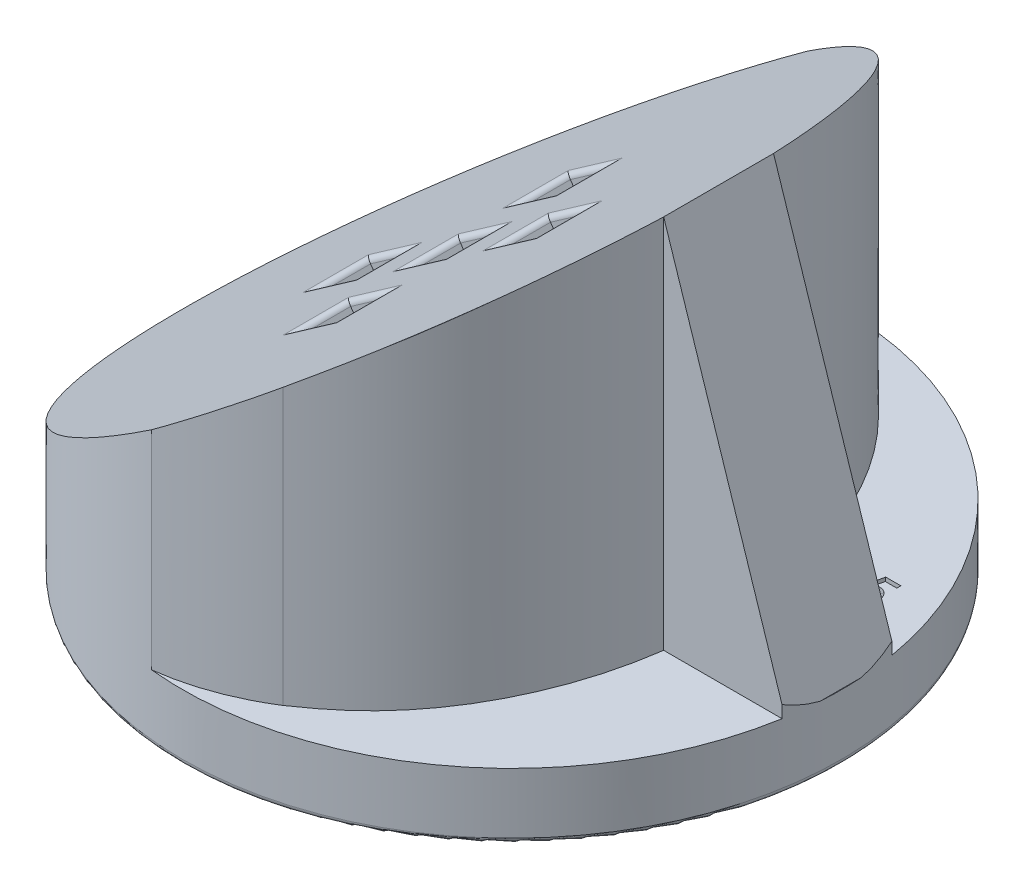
SolidWorks part; units mm, degrees
ref_plane "Front Plane" through (0, 0, 0) normal (0, 0, 1) x (1, 0, 0)
ref_plane "Top Plane" through (0, 0, 0) normal (0, 1, 0) x (1, 0, 0)
ref_plane "Right Plane" through (0, 0, 0) normal (1, 0, 0) x (0, 0, -1)
sketch "Sketch1" plane through (0, 0, 0) normal (0, 1, 0) x (1, 0, 0)
  circle A0 centre (0, 0) radius 30
extrude "Boss-Extrude1" add sketch "Sketch1" along normal blind 50
sketch "Sketch3" plane through (0, 50, 0) normal (0, 1, 0) x (1, 0, 0)
sketch "Sketch4" plane through (0, 0, 0) normal (0, -1, 0) x (-1, 0, 0)
  line L0 (0, 0) -> (-10, 0) construction
  line L1 (0, 0) -> (0, -10) construction
  line L2 (0, 0) -> (0, 10) construction
  line L3 (0, 0) -> (10, 0) construction
  line L5 (-2.5, 2.5) -> (2.5, 2.5)
  line L6 (-2.5, 2.5) -> (-2.5, -2.5)
  line L7 (-2.5, -2.5) -> (2.5, -2.5)
  line L8 (2.5, 2.5) -> (2.5, -2.5)
  line L9 (-2.5, 2.5) -> (2.5, -2.5) construction
  line L10 (-2.5, -2.5) -> (2.5, 2.5) construction
  line L11 (-2.5, -7.5) -> (2.5, -7.5)
  line L12 (-2.5, -7.5) -> (-2.5, -12.5)
  line L13 (-2.5, -12.5) -> (2.5, -12.5)
  line L14 (2.5, -7.5) -> (2.5, -12.5)
  line L15 (-2.5, -7.5) -> (2.5, -12.5) construction
  line L16 (-2.5, -12.5) -> (2.5, -7.5) construction
  line L17 (7.5, 2.5) -> (12.5, 2.5)
  line L18 (7.5, 2.5) -> (7.5, -2.5)
  line L19 (7.5, -2.5) -> (12.5, -2.5)
  line L20 (12.5, 2.5) -> (12.5, -2.5)
  line L21 (7.5, 2.5) -> (12.5, -2.5) construction
  line L22 (7.5, -2.5) -> (12.5, 2.5) construction
  line L23 (-12.5, 2.5) -> (-7.5, 2.5)
  line L24 (-12.5, 2.5) -> (-12.5, -2.5)
  line L25 (-12.5, -2.5) -> (-7.5, -2.5)
  line L26 (-7.5, 2.5) -> (-7.5, -2.5)
  line L27 (-12.5, 2.5) -> (-7.5, -2.5) construction
  line L28 (-12.5, -2.5) -> (-7.5, 2.5) construction
  line L29 (2.5, 7.5) -> (-2.5, 7.5)
  line L30 (2.5, 7.5) -> (2.5, 12.5)
  line L31 (2.5, 12.5) -> (-2.5, 12.5)
  line L32 (-2.5, 7.5) -> (-2.5, 12.5)
  line L33 (2.5, 7.5) -> (-2.5, 12.5) construction
  line L34 (2.5, 12.5) -> (-2.5, 7.5) construction
  dimension "D1" = 5
  dimension "D2" = 5
  dimension "D3" = 5
  dimension "D4" = 5
  dimension "D5" = 5
  dimension "D6" = 5
extrude "Cut-Extrude2" cut sketch "Sketch4" against normal blind 3
fillet "Fillet2" radius 0.5 21 edges at (0, 0, 30) (2.5, 0, 0) (0, 0, 2.5) (-2.5, 0, 0) (0, 0, -2.5) (2.5, 0, 10) (0, 0, 12.5) (-2.5, 0, 10) (0, 0, 7.5) (-7.5, 0, 0) (-10, 0, 2.5) (-12.5, 0, 0) (-10, 0, -2.5) (12.5, 0, 0) (10, 0, 2.5) (7.5, 0, 0) (10, 0, -2.5) (-2.5, 0, -10) (0, 0, -12.5) (2.5, 0, -10) (0, 0, -7.5)
ref_plane "Plane6" through (0, 0, 3.5) normal (0, 0, 1) x (1, 0, 0)
sketch "Sketch13" plane through (0, 0, 3.5) normal (0, 0, 1) x (1, 0, 0)
  line L0 (-30, 6) -> (30, 48.0125)
  line L1 (-30, 50) -> (-30, 0.5) construction
  line L2 (30, 0.5) -> (30, 50) construction
  line L3 (30, 48.0125) -> (30, 50)
  line L4 (30, 50) -> (-30, 50)
  line L5 (-30, 50) -> (-30, 6)
  line L6 (30, 0.5) -> (-30, 0.5) construction
  dimension "D1" = 5.5
  dimension "D2" = 35
extrude "Cut-Extrude10" cut sketch "Sketch13" against normal mid plane 90
ref_plane "Plane4" through (0, 0, -2.5) normal (0, 0, -1) x (-1, 0, 0)
ref_plane "Plane5" through (0, 0, -62.5) normal (0, 0, -1) x (-1, 0, 0)
sketch "Sketch15" plane through (-12.6888, 18.1214, 0) normal (-0.5736, 0.8192, 0) x (0.8192, 0.5736, 0)
  line L0 (-21.1331, 0) -> (0, 0) construction
  line L2 (1.3669, -2.5) -> (-3.6331, -2.5)
  line L3 (1.3669, -2.5) -> (1.3669, 2.5)
  line L4 (1.3669, 2.5) -> (-3.6331, 2.5)
  line L5 (-3.6331, -2.5) -> (-3.6331, 2.5)
  line L6 (1.3669, -2.5) -> (-3.6331, 2.5) construction
  line L7 (1.3669, 2.5) -> (-3.6331, -2.5) construction
  line L8 (11.3669, -2.5) -> (6.3669, -2.5)
  line L9 (11.3669, -2.5) -> (11.3669, 2.5)
  line L10 (11.3669, 2.5) -> (6.3669, 2.5)
  line L11 (6.3669, -2.5) -> (6.3669, 2.5)
  line L12 (11.3669, -2.5) -> (6.3669, 2.5) construction
  line L13 (11.3669, 2.5) -> (6.3669, -2.5) construction
  line L14 (21.3669, -2.5) -> (16.3669, -2.5)
  line L15 (21.3669, -2.5) -> (21.3669, 2.5)
  line L16 (21.3669, 2.5) -> (16.3669, 2.5)
  line L17 (16.3669, -2.5) -> (16.3669, 2.5)
  line L18 (21.3669, -2.5) -> (16.3669, 2.5) construction
  line L19 (21.3669, 2.5) -> (16.3669, -2.5) construction
  line L20 (11.3669, -12.5) -> (6.3669, -12.5)
  line L21 (11.3669, -12.5) -> (11.3669, -7.5)
  line L22 (11.3669, -7.5) -> (6.3669, -7.5)
  line L23 (6.3669, -12.5) -> (6.3669, -7.5)
  line L24 (11.3669, -12.5) -> (6.3669, -7.5) construction
  line L25 (11.3669, -7.5) -> (6.3669, -12.5) construction
  line L26 (11.3669, 7.5) -> (6.3669, 7.5)
  line L27 (11.3669, 7.5) -> (11.3669, 12.5)
  line L28 (11.3669, 12.5) -> (6.3669, 12.5)
  line L29 (6.3669, 7.5) -> (6.3669, 12.5)
  line L30 (11.3669, 7.5) -> (6.3669, 12.5) construction
  line L31 (11.3669, 12.5) -> (6.3669, 7.5) construction
  ellipse E0 centre (15.4901, 0) end of major axis (-21.1331, 0) minor radius 30 construction
  point P9 (-1.1331, 0)
  point P14 (8.8669, 0)
  point P19 (18.8669, 0)
  point P24 (8.8669, -10)
  point P29 (8.8669, 10)
  dimension "D1" = 40
  dimension "D2" = 30
  dimension "D3" = 20
  dimension "D4" = 5
  dimension "D5" = 5
  dimension "D6" = 5
  dimension "D7" = 5
  dimension "D8" = 5
  dimension "D9" = 5
  dimension "D10" = 5
  dimension "D11" = 5
  dimension "D12" = 10
  dimension "D13" = 10
  dimension "D14" = 5
  dimension "D15" = 5
extrude "Cut-Extrude11" cut sketch "Sketch15" against normal blind 3
ref_plane "Plane7" through (0, 0, 0) normal (0, 0, -1) x (-1, 0, 0)
sketch "Sketch24" plane through (-12.6888, 18.1214, 0) normal (-0.5736, 0.8192, 0) x (0.8192, 0.5736, 0)
  line L0 (8.8669, -30) -> (43.5601, -46.7605)
  line L1 (8.8669, 0) -> (-21.1331, 0)
  line L3 (43.5601, -46.7605) -> (61.6872, 6.9328)
  line L4 (61.6872, 6.9328) -> (28.4166, 53.986)
  line L5 (28.4166, 53.986) -> (8.8669, 34.4662)
  line L6 (8.8669, 34.4662) -> (8.8669, 30)
  arc A0 (8.8669, -30) -> (-21.1331, 0) centre (8.8669, 0) ccw
  ellipse E1 centre (15.4901, 0) end of major axis (-21.1331, 0) minor radius 30 construction
  dimension "D1" = 30
extrude "Cut-Extrude13" cut sketch "Sketch24" against normal blind 100 contours A0 M21
fillet "Fillet8" radius 0.5 4 edges at (-5.4254, 23.2073, -7.5) (-3.3776, 24.6412, -10) (-5.4254, 23.2073, -12.5) (-7.4733, 21.7734, -10)
fillet "Fillet9" radius 0.5 4 edges at (2.7661, 28.9431, 2.5) (4.814, 30.377, 0) (2.7661, 28.9431, -2.5) (0.7182, 27.5091, 0)
fillet "Fillet10" radius 0.5 4 edges at (-15.6648, 16.0376, 0) (-13.617, 17.4715, 2.5) (-11.5691, 18.9055, 0) (-13.617, 17.4715, -2.5)
fillet "Fillet11" radius 0.5 4 edges at (-7.4733, 21.7734, 10) (-5.4254, 23.2073, 12.5) (-3.3776, 24.6412, 10) (-5.4254, 23.2073, 7.5)
fillet "Fillet12" radius 0.5 4 edges at (-7.4733, 21.7734, 0) (-5.4254, 23.2073, 2.5) (-3.3776, 24.6412, 0) (-5.4254, 23.2073, -2.5)
ref_plane "Plane8" through (0, 6, 0) normal (0, -1, 0) x (-1, 0, 0)
sketch "Sketch25" plane through (0, 6, 0) normal (0, -1, 0) x (-1, 0, 0)
  line L0 (2.9824, 29.8514) -> (2.9824, 40.4356)
  line L1 (2.9824, 40.4356) -> (-36.5078, 40.4356)
  line L2 (-36.5078, 40.4356) -> (-36.5078, 5)
  line L3 (2.9824, -29.8514) -> (2.9824, -34.0821)
  line L4 (2.9824, -34.0821) -> (-36.5078, -34.0821)
  line L5 (-36.5078, -34.0821) -> (-36.5078, -5)
  line L8 (-36.5078, -5) -> (-18.8054, -5)
  line L9 (-36.5078, 5) -> (-18.8054, 5)
  ellipse E0 centre (5.4254, 0) end of major axis (5.4254, -30) minor radius 24.5746 (2.9824, 29.8514) -> (2.9824, -29.8514) ccw construction
  spline S0 degree 3 poles (2.9824, 29.8514) (-0.1336, 29.4798) (-4.8114, 27.7264) (-10.4189, 23.261) (-14.5569, 18.037) (-17.4715, 11.6686) (-18.5192, 7.0668) (-18.8054, 5) knots 0 0 0 0 0.114664 0.178839 0.260999 0.356747 0.433183 0.433183 0.433183 0.433183
  spline S1 degree 3 poles (-5.8147, -26.678) (-3.1614, -28.3518) (-0.1346, -29.4741) (2.9824, -29.8514) knots 0 0 0 0 1 1 1 1
  spline S2 degree 3 poles (-18.8054, -5) (-18.6015, -6.4728) (-17.825, -10.3189) (-15.471, -16.4366) (-11.3194, -22.4805) (-7.6514, -25.4461) (-5.8147, -26.678) knots 0.555654 0.555654 0.555654 0.555654 0.610076 0.699017 0.794824 0.873696 0.873696 0.873696 0.873696
extrude "Cut-Extrude14" cut sketch "Sketch25" against normal blind 50
sketch "Sketch26" plane through (0, 0, 3.5) normal (0, 0, 1) x (1, 0, 0)
  line L0 (18.8054, 40.1739) -> (29.9409, 6)
  line L1 (-32.45, 6) -> (32.45, 6) construction
  line L2 (29.9409, 6) -> (32.4602, 6)
  line L3 (32.4602, 6) -> (31.2006, 39.6133)
  line L4 (31.2006, 39.6133) -> (18.8054, 40.1739)
extrude "Cut-Extrude15" cut sketch "Sketch26" against normal mid plane 50
sketch "Sketch27" plane through (0, 6, 0) normal (0, 1, 0) x (1, 0, 0)
  text T0 "<b>35</b>"
extrude "Cut-Extrude16" cut sketch "Sketch27" against normal blind 2
